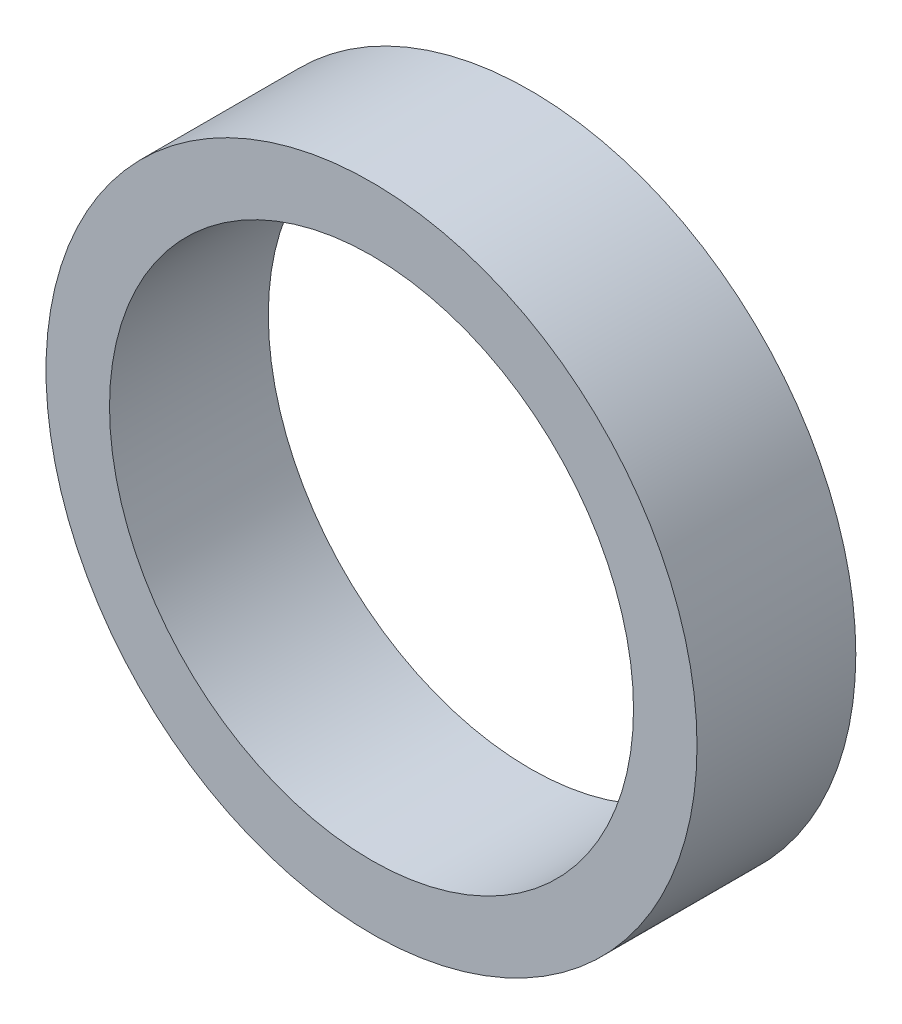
SolidWorks part; units mm, degrees
ref_plane "Plan de face" through (0, 0, 0) normal (0, 0, 1) x (1, 0, 0)
ref_plane "Plan de dessus" through (0, 0, 0) normal (0, 1, 0) x (1, 0, 0)
ref_plane "Plan de droite" through (0, 0, 0) normal (1, 0, 0) x (0, 0, -1)
sketch "Esquisse1" plane through (0, 0, 0) normal (0, 0, 1) x (1, 0, 0)
  circle A0 centre (0, 0) radius 16.5
  circle A1 centre (0, 0) radius 20.5
  dimension "D1" = 41
  dimension "D2" = 33
extrude "Extrusion1" add sketch "Esquisse1" along normal blind 10
